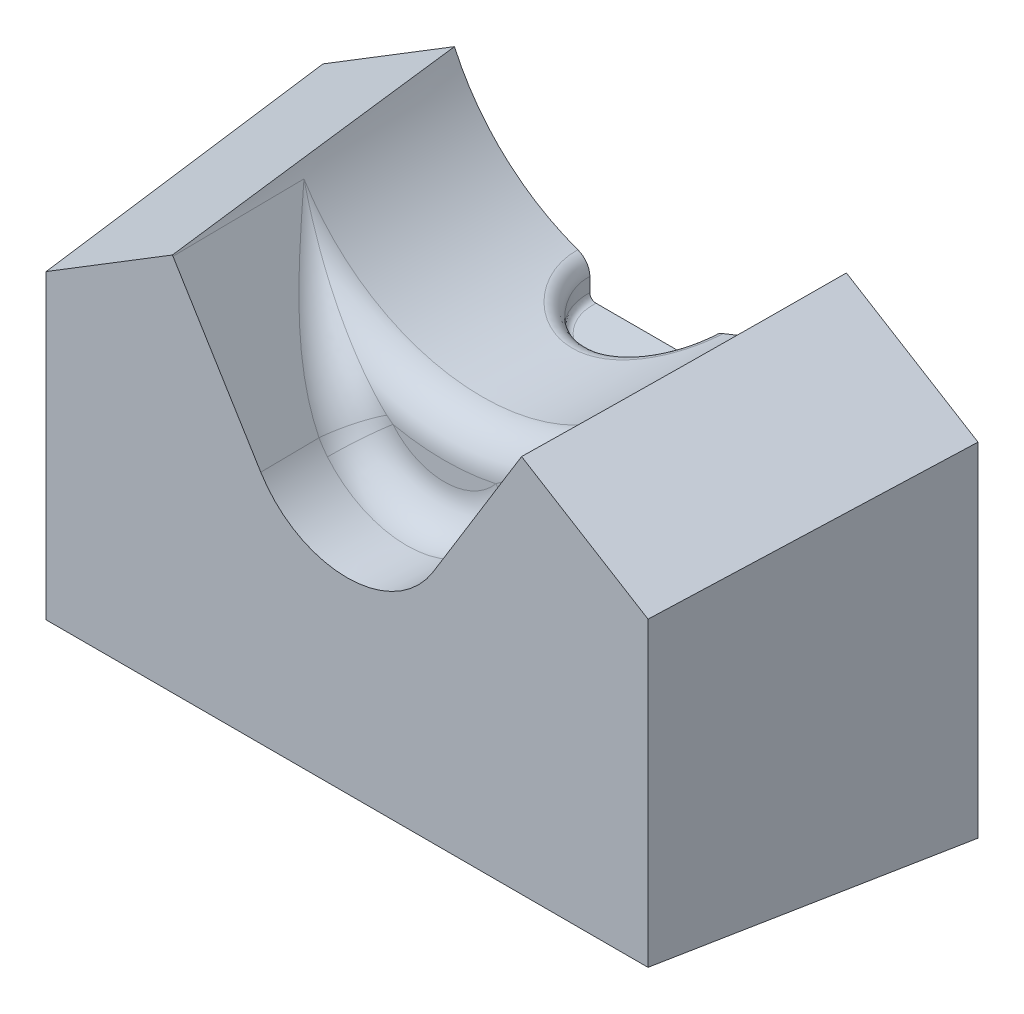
SolidWorks part; units mm, degrees
ref_plane "Plan de face" through (0, 0, 0) normal (0, 0, 1) x (1, 0, 0)
ref_plane "Plan de dessus" through (0, 0, 0) normal (0, 1, 0) x (1, 0, 0)
ref_plane "Plan de droite" through (0, 0, 0) normal (1, 0, 0) x (0, 0, -1)
sketch "Esquisse1" plane through (0, 0, 0) normal (0, 0, 1) x (1, 0, 0)
  line L6 (-52.9708, -64.2009) -> (-82.9708, -82.6129)
  line L7 (-82.9708, -82.6129) -> (-82.9708, -132.6129)
  line L8 (-82.9708, -132.6129) -> (17.0292, -132.6129)
  line L9 (17.0292, -132.6129) -> (17.0292, -82.6129)
  line L10 (17.0292, -82.6129) -> (-12.9708, -64.2009)
  line L11 (-12.9708, -64.2009) -> (-52.9708, -64.2009)
  line L12 (-52.9708, -64.2009) -> (-82.9708, -82.6129)
  line L13 (-82.9708, -82.6129) -> (-82.9708, -132.6129)
  line L14 (-82.9708, -132.6129) -> (17.0292, -132.6129)
  line L15 (17.0292, -132.6129) -> (17.0292, -82.6129)
  line L16 (17.0292, -82.6129) -> (-12.9708, -64.2009)
  line L17 (-12.9708, -64.2009) -> (-52.9708, -64.2009)
  line L72 (-32.9708, -51.9262) -> (-88.984, -86.3705) construction
  dimension "D2" = 100
  dimension "D3" = 50
  dimension "D4" = 80.6867
  dimension "D1" = 0
extrude "Extrusion1" add sketch "Esquisse1" against normal up to vertex draft 5
other "Empreinte1"
other "PièceBrute+Dep+Ret<1>@outillage"
sketch "Esquisse2" plane through (0, 0, 0) normal (0, 1, 0) x (-1, 0, 0)
  line L0 (84.3743, -1.9497) -> (-28.7563, -1.9497)
extrude "Enlèv. mat.-Extru.1" cut sketch "Esquisse2" against normal through all and the other way through all flip side to cut
